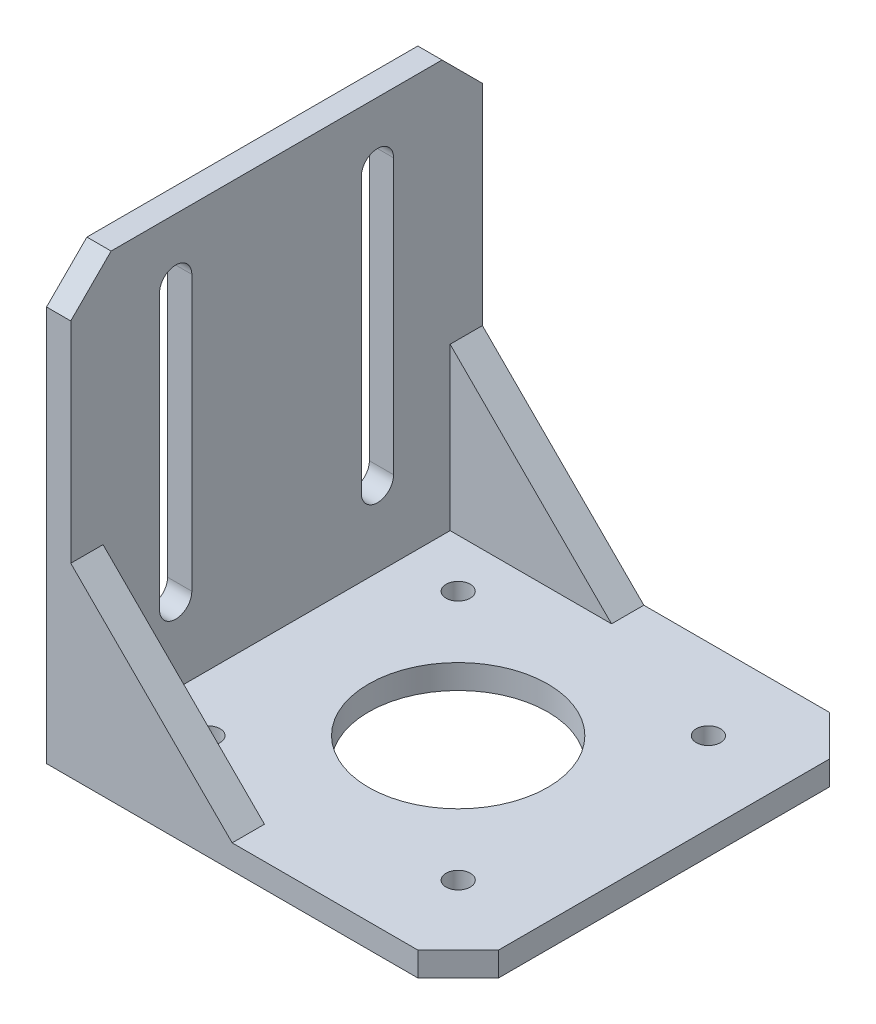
SolidWorks part; units mm, degrees
ref_plane "Front Plane" through (0, 0, 0) normal (0, 0, 1) x (1, 0, 0)
ref_plane "Top Plane" through (0, 0, 0) normal (0, 1, 0) x (1, 0, 0)
ref_plane "Right Plane" through (0, 0, 0) normal (1, 0, 0) x (0, 0, -1)
sketch "Sketch1" plane through (0, 0, 0) normal (0, 1, 0) x (1, 0, 0)
  line L0 (0, 75.2527) -> (0, -22.9683) construction
  line L1 (-25.5, -25.5) -> (20.5, -25.5)
  line L2 (-25.5, -25.5) -> (-25.5, 25.5)
  line L3 (-25.5, 25.5) -> (20.5, 25.5)
  line L4 (25.5, -20.5) -> (25.5, 20.5)
  line L5 (-15.4593, 0) -> (113.9393, 0) construction
  line L6 (20.5, -25.5) -> (25.5, -20.5)
  line L7 (25.5, 20.5) -> (20.5, 25.5)
  line L8 (-15.5, -15.5) -> (15.5, 15.5) construction
  line L9 (-15.5, 15.5) -> (15.5, 15.5) construction
  line L10 (-15.5, 15.5) -> (-15.5, -15.5) construction
  line L11 (-15.5, -15.5) -> (15.5, -15.5) construction
  line L12 (15.5, 15.5) -> (15.5, -15.5) construction
  line L13 (15.5, 15.5) -> (11.15, 15.5) construction
  line L14 (-15.5, 15.5) -> (15.5, -15.5) construction
  circle A0 centre (0, 0) radius 11.1
  circle A1 centre (15.5, 15.5) radius 1.5
  circle A2 centre (-15.5, 15.5) radius 1.5
  circle A3 centre (-15.5, -15.5) radius 1.5
  circle A4 centre (15.5, -15.5) radius 1.5
  point P1 (25.5, 25.5)
  point P3 (25.5, -25.5)
  dimension "D3" = 22.2
  dimension "D4" = 3
  dimension "D1" = 51
  dimension "D2" = 51
  dimension "D5" = 31
extrude "Boss-Extrude1" add sketch "Sketch1" along normal blind 3
sketch "Sketch2" plane through (-25.5, 0, 0) normal (-1, 0, 0) x (0, 0, 1)
  line L0 (-25.5, 3) -> (25.5, 3) construction
  line L1 (-25.5, 3) -> (25.5, 3)
  line L2 (-25.5, 3) -> (-25.5, 49)
  line L3 (-20.5, 54) -> (20.5, 54)
  line L4 (25.5, 3) -> (25.5, 49)
  line L5 (-25.5, 49) -> (-20.5, 54)
  line L6 (20.5, 54) -> (25.5, 49)
  line L7 (0, 81.5142) -> (0, -12.6969) construction
  line L8 (-12.5, 46.5) -> (12.5, 46.5) construction
  line L9 (-12.5, 46.5) -> (-12.5, 12.5) construction
  line L10 (-12.5, 12.5) -> (12.5, 12.5) construction
  line L11 (12.5, 46.5) -> (12.5, 12.5) construction
  line L12 (-12.5, 46.5) -> (-12.5, 12.5) construction
  line L13 (-10.5, 46.5) -> (-10.5, 12.5)
  line L14 (-14.5, 46.5) -> (-14.5, 12.5)
  line L15 (12.5, 46.5) -> (12.5, 12.5) construction
  line L16 (14.5, 46.5) -> (14.5, 12.5)
  line L17 (10.5, 46.5) -> (10.5, 12.5)
  arc A4 (-10.5, 46.5) -> (-14.5, 46.5) centre (-12.5, 46.5) ccw
  arc A5 (-14.5, 12.5) -> (-10.5, 12.5) centre (-12.5, 12.5) ccw
  arc A6 (14.5, 46.5) -> (10.5, 46.5) centre (12.5, 46.5) ccw
  arc A7 (10.5, 12.5) -> (14.5, 12.5) centre (12.5, 12.5) ccw
  point P1 (25.5, 54)
  point P2 (-25.5, 54)
  point P22 (-12.5, 29.5)
  point P27 (12.5, 29.5)
  dimension "D2" = 2
  dimension "D3" = 2
  dimension "D1" = 51
  dimension "D6" = 25
  dimension "D7" = 34
  dimension "D8" = 12.5
  dimension "D9" = 7.5
extrude "Boss-Extrude2" add sketch "Sketch2" against normal blind 3
ref_plane "Plane1" through (-22.5, 3, 25.5) normal (0, 0, 1) x (1, 0, 0)
sketch "Sketch5" plane through (0, 0, 25.5) normal (0, 0, 1) x (1, 0, 0)
  line L0 (-22.5, 23) -> (-2.5, 3)
  line L1 (-22.5, 3) -> (-22.5, 49) construction
  line L2 (-22.5, 3) -> (20.5, 3) construction
  dimension "D1" = 20
  dimension "D2" = 20
rib "Rib2" sketch "Sketch5" sketch "Sketch5" thickness 4 extrusion direction parallel to sketch draft on no parameters "D1"=4
mirror "Mirror1" about plane through (0, 0, 0) normal (0, 0, 1) of "Rib2"
